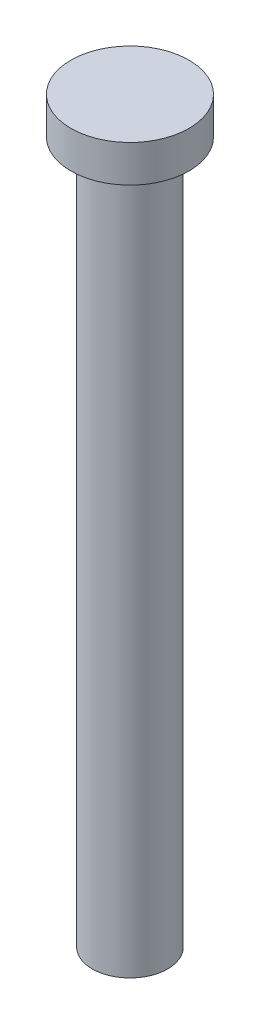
SolidWorks part; units mm, degrees
ref_plane "Front Plane" through (0, 0, 0) normal (0, 0, 1) x (1, 0, 0)
ref_plane "Top Plane" through (0, 0, 0) normal (0, 1, 0) x (1, 0, 0)
ref_plane "Right Plane" through (0, 0, 0) normal (1, 0, 0) x (0, 0, -1)
sketch "PinDia" plane through (0, 0, 0) normal (0, 1, 0) x (1, 0, 0)
  circle A0 centre (0, 0) radius 5.1
  dimension "D1" = 10.2
extrude "Length" add sketch "PinDia" against normal blind 100
sketch "HeadDia" plane through (0, 0, 0) normal (0, 1, 0) x (1, 0, 0)
  circle A0 centre (0, 0) radius 8
  dimension "D1" = 16
extrude "HeadThickness" add sketch "HeadDia" against normal blind 5
fillet "Fillet1" radius 0.5 1 edges at (0, -5, 5.1)
